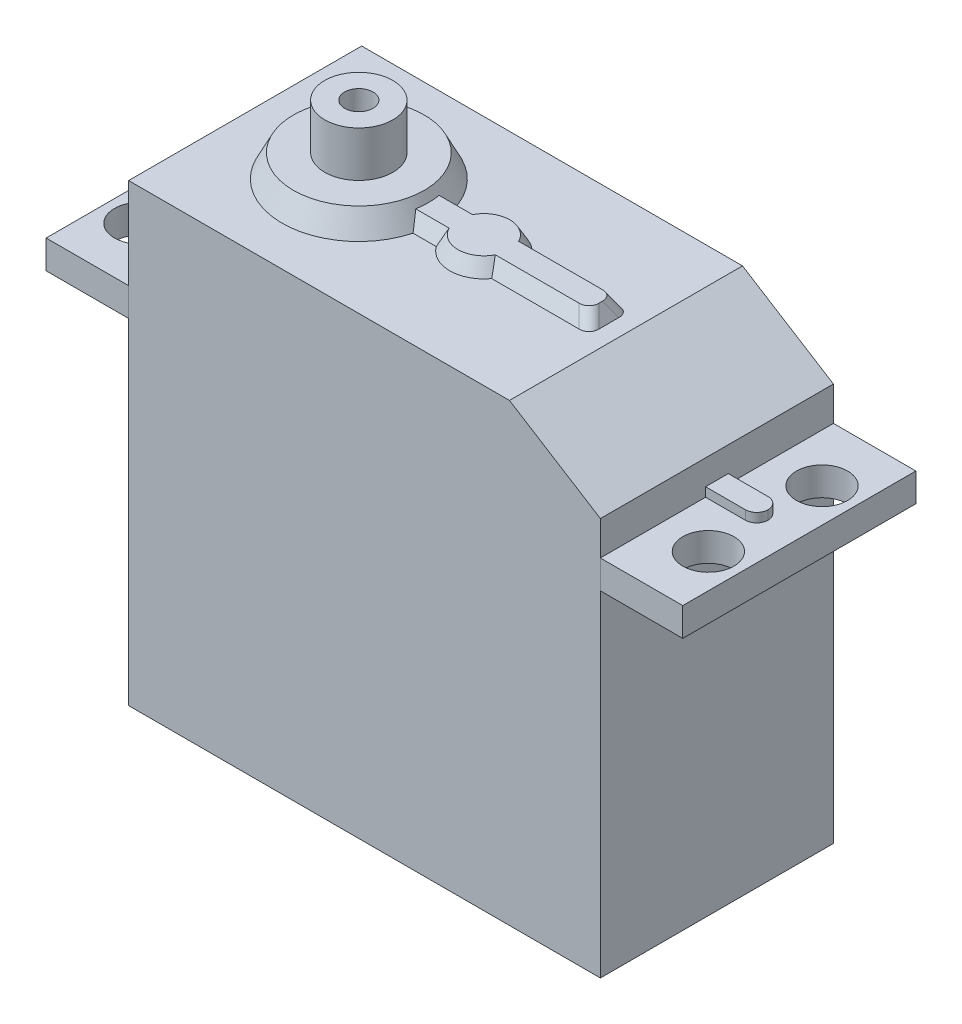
SolidWorks part; units mm, degrees
ref_plane "Front Plane" through (0, 0, 0) normal (0, 0, 1) x (1, 0, 0)
ref_plane "Top Plane" through (0, 0, 0) normal (0, 1, 0) x (1, 0, 0)
ref_plane "Right Plane" through (0, 0, 0) normal (1, 0, 0) x (0, 0, -1)
sketch "Sketch1" plane through (0, 0, 0) normal (0, 1, 0) x (1, 0, 0)
  line L1 (-10, 10.25) -> (31.5, 10.25)
  line L2 (-10, 10.25) -> (-10, -10.25)
  line L3 (-10, -10.25) -> (31.5, -10.25)
  line L4 (31.5, 10.25) -> (31.5, -10.25)
  circle A0 centre (0, 0) radius 1.25
  dimension "D1" = 10
  dimension "D2" = 41.5
  dimension "D3" = 10.25
  dimension "D4" = 20.5
extrude "Boss-Extrude1" add sketch "Sketch1" against normal blind 40
chamfer "Chamfer1" distance 5 distance2 8 1 edges at (31.5, 0, 0)
ref_plane "Plane1" through (0, -8, 0) normal (0, 1, 0) x (1, 0, 0)
sketch "Sketch2" plane through (0, -8, 0) normal (0, 1, 0) x (1, 0, 0)
  line L0 (-17.25, -0.0031) -> (38.75, -0.0031) construction
  line L1 (-10, 10.25) -> (-17.25, 10.25)
  line L2 (-10, 10.25) -> (-10, -10.2561)
  line L3 (-10, -10.2561) -> (-17.25, -10.2561)
  line L4 (-17.25, 10.25) -> (-17.25, -10.2561)
  line L5 (31.5, 10.25) -> (38.75, 10.25)
  line L6 (31.5, 10.25) -> (31.5, -10.2561)
  line L7 (31.5, -10.2561) -> (38.75, -10.2561)
  line L8 (38.75, 10.25) -> (38.75, -10.2561)
  line L9 (38.75, -0.0031) -> (10.75, -0.0031) construction
  line L10 (10.75, -0.0031) -> (10.75, 6.339) construction
  circle A0 centre (-14.25, 4.9969) radius 2.25
  circle A1 centre (35.75, 4.9969) radius 2.25
  circle A2 centre (35.75, -5.0031) radius 2.25
  circle A3 centre (-14.25, -5.0031) radius 2.25
  dimension "D4" = 4.5
  dimension "D1" = 7.25
  dimension "D2" = 7.25
  dimension "D3" = 25
  dimension "D5" = 5
extrude "Boss-Extrude2" add sketch "Sketch2" against normal blind 2.5
sketch "Sketch3" plane through (0, -8, 0) normal (0, 1, 0) x (1, 0, 0)
  line L0 (-10, -10.25) -> (-10, 10.25) construction
  line L1 (-14.5, 1) -> (36, 1)
  line L2 (-14.5, 1) -> (-14.5, -1)
  line L3 (-14.5, -1) -> (36, -1)
  line L4 (36, 1) -> (36, -1)
  line L5 (31.5, 10.25) -> (31.5, -10.25) construction
  dimension "D1" = 1
  dimension "D2" = 2
  dimension "D3" = 4.5
  dimension "D4" = 4.5
extrude "Boss-Extrude3" add sketch "Sketch3" along normal blind 0.8
fillet "Fillet1" radius 1 4 edges at (36, -7.6, 1) (36, -7.6, -1) (-14.5, -7.6, -1) (-14.5, -7.6, 1)
sketch "Sketch4" plane through (0, 0, 0) normal (0, 1, 0) x (1, 0, 0)
  circle A0 centre (0, 0) radius 6.75
extrude "Boss-Extrude4" add sketch "Sketch4" along normal blind 2
chamfer "Chamfer2" distance 2 distance2 1 1 edges at (0, 2, 6.75)
sketch "Sketch5" plane through (0, 0, 0) normal (0, 1, 0) x (1, 0, 0)
  line L0 (13.4367, 1.75) -> (22, 1.75)
  line L1 (2.9829, 1.75) -> (8.5633, 1.75)
  line L2 (2.9829, 1.75) -> (2.9829, -1.75)
  line L3 (2.9829, -1.75) -> (8.5633, -1.75)
  line L4 (22, 1.75) -> (22, -1.75)
  line L5 (13.4367, -1.75) -> (22, -1.75)
  arc A0 (8.5633, -1.75) -> (13.4367, -1.75) centre (11, 0) ccw
  arc A1 (13.4367, 1.75) -> (8.5633, 1.75) centre (11, 0) ccw
  dimension "D5" = 6
  dimension "D1" = 1.75
  dimension "D2" = 3.5
  dimension "D3" = 22
  dimension "D4" = 11
extrude "Boss-Extrude5" add sketch "Sketch5" along normal blind 1.25 draft 30 contours L1 A1 L0 L4 L5 A0 L3 L2
fillet "Fillet2" radius 1 2 edges at (21.6392, 0.625, 1.3892) (21.6392, 0.625, -1.3892)
sketch "Sketch6" plane through (0, 0, 0) normal (0, 1, 0) x (1, 0, 0)
  circle A0 centre (0, 0) radius 3
  circle A1 centre (0, 0) radius 1.25
extrude "Boss-Extrude6" add sketch "Sketch6" along normal blind 6
sketch "Sketch7" plane through (-10, 0, 0) normal (-1, 0, 0) x (0, 0, 1)
  line L0 (-10.25, -40) -> (10.25, -40) construction
  line L1 (-3.5, -31) -> (3.5, -31)
  line L2 (-3.5, -31) -> (-3.5, -35.5)
  line L3 (-3.5, -35.5) -> (3.5, -35.5)
  line L4 (3.5, -31) -> (3.5, -35.5)
  circle A0 centre (0, -22) radius 2
  dimension "D5" = 18
  dimension "D1" = 7
  dimension "D2" = 3.5
  dimension "D3" = 4.5
  dimension "D4" = 4.5
extrude "Boss-Extrude7" add sketch "Sketch7" along normal blind 5
